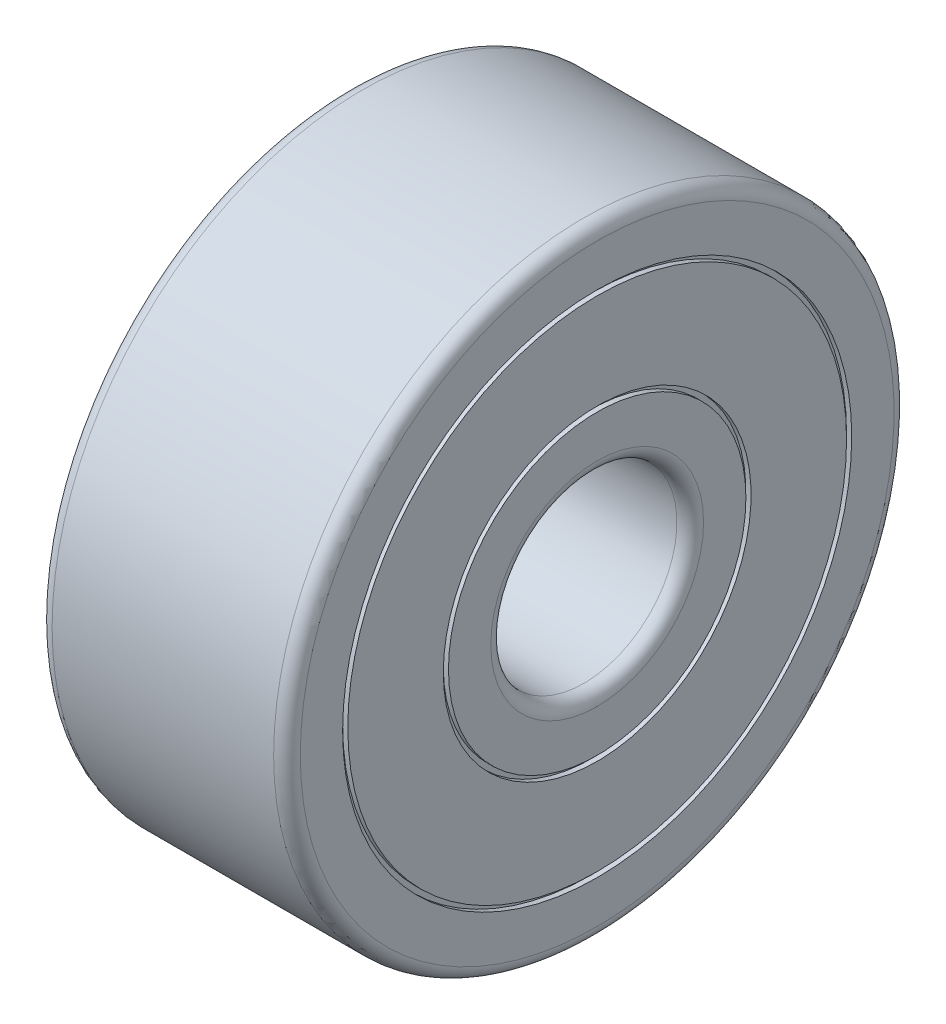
SolidWorks part; units mm, degrees
ref_plane "Front" through (0, 0, 0) normal (0, 0, 1) x (1, 0, 0)
ref_plane "Top" through (0, 0, 0) normal (0, 1, 0) x (1, 0, 0)
ref_plane "Right" through (0, 0, 0) normal (1, 0, 0) x (0, 0, -1)
sketch "Support-Front-Body" plane through (0, 0, 0) normal (0, 0, 1) x (1, 0, 0)
  line L0 (-2, 0) -> (2, 0) construction
  line L1 (0, 5) -> (0, -5) construction
  line L2 (-1.7851, 5) -> (1.7851, 5)
  line L3 (-1.7851, -5) -> (1.7851, -5)
  line L4 (2, 4.7851) -> (2, 1.7149)
  line L5 (2, -4.7851) -> (2, -1.7149)
  line L6 (1.7851, 1.5) -> (-1.7851, 1.5)
  line L7 (1.7851, -1.5) -> (-1.7851, -1.5)
  line L8 (-2, 1.7149) -> (-2, 4.7851)
  line L9 (-2, -1.7149) -> (-2, -4.7851)
  line L10 (2, 1.7149) -> (2, -1.7149) construction
  line L11 (-2, 1.7149) -> (-2, -1.7149) construction
  line L12 (2, 3.25) -> (-2, 3.25) construction
  line L13 (2, -3.25) -> (-2, -3.25) construction
  line L14 (1.7851, 5) -> (2, 3.25) construction
  line L15 (1.7851, -5) -> (2, -3.25) construction
  arc A0 (1.7851, 5) -> (2, 4.7851) centre (1.7851, 4.7851) cw
  arc A1 (1.7851, -5) -> (2, -4.7851) centre (1.7851, -4.7851) ccw
  arc A2 (2, 1.7149) -> (1.7851, 1.5) centre (1.7851, 1.7149) cw
  arc A3 (2, -1.7149) -> (1.7851, -1.5) centre (1.7851, -1.7149) ccw
  arc A4 (-1.7851, 1.5) -> (-2, 1.7149) centre (-1.7851, 1.7149) cw
  arc A5 (-1.7851, -1.5) -> (-2, -1.7149) centre (-1.7851, -1.7149) ccw
  arc A6 (-2, 4.7851) -> (-1.7851, 5) centre (-1.7851, 4.7851) cw
  arc A7 (-2, -4.7851) -> (-1.7851, -5) centre (-1.7851, -4.7851) ccw
  dimension "Diam-Out" = 10
  dimension "Diam-Inner" = 3
  dimension "Width" = 4
  dimension "D4" = 7
sketch "Support-Front-Balls" plane through (0, 0, 0) normal (0, 0, 1) x (1, 0, 0)
  line L0 (-2, 0) -> (2, 0) construction
  line L1 (-2, 0) -> (2, 0) construction
  line L2 (-2, 3.8333) -> (2, 3.8333)
  line L3 (0, 5) -> (2, 3.8333) construction
  line L4 (-2, 1.7149) -> (-2, 4.7851) construction
  line L5 (2, 4.7851) -> (2, 1.7149) construction
  line L6 (-2, 2.6667) -> (2, 2.6667)
  line L7 (2, 3.25) -> (-2, 3.25) construction
  line L8 (0, 5) -> (0, -5) construction
  line L9 (-1.7851, 5) -> (-1.7851, 3.8333) construction
  line L10 (0, 5) -> (0, -5) construction
  line L11 (-1.7851, 3.8333) -> (-1.7851, 2.6667) construction
  line L12 (2, 3.8333) -> (0, 4.3788) construction
  line L13 (2, 3.8333) -> (0, 4.3391) construction
  line L14 (2, 3.25) -> (-2, 3.25) construction
  circle A0 centre (0, 3.25) radius 1.0891
  circle A1 centre (0, -3.25) radius 1.0891
  circle A2 centre (0, 3.25) radius 1.0558
  dimension "D1" = 15
  dimension "Diam-Pitch" = 6.5
sketch "Support-Front-Side" plane through (0, 0, 0) normal (0, 0, 1) x (1, 0, 0)
  line L0 (0, 3.8333) -> (1.5279, 4.1027) construction
  line L1 (-2, 3.8333) -> (2, 3.8333) construction
  line L2 (-2, 2.6667) -> (2, 2.6667) construction
  line L3 (2, 3.25) -> (1.5279, 3.25) construction
  line L4 (2, 4.1027) -> (1.5279, 4.1027)
  line L5 (2, 3.25) -> (-2, 3.25) construction
  line L6 (2, 4.7851) -> (2, 1.7149) construction
  line L7 (2, 2.3973) -> (1.5279, 2.3973)
  line L8 (1.5279, 4.1027) -> (1.5279, 2.3973)
  line L9 (1.5279, 3.25) -> (1.0558, 3.25) construction
  line L10 (1.9168, 4.1027) -> (1.9168, 4.0195)
  line L14 (1.9168, 2.3973) -> (1.9168, 2.4805)
  line L16 (0, 5) -> (0, -5) construction
  line L17 (0, 5) -> (0, -5) construction
  line L18 (1.9168, 4.0195) -> (2, 4.0195)
  line L19 (1.9168, 2.4805) -> (2, 2.4805)
  line L20 (2, 4.0195) -> (1.5279, 4.1027) construction
  line L21 (2, 2.4805) -> (1.5279, 2.3973) construction
  line L22 (-1.9168, 2.4805) -> (-2, 2.4805)
  line L23 (-1.9168, 2.3973) -> (-1.9168, 2.4805)
  line L24 (-2, 2.3973) -> (-1.5279, 2.3973)
  line L25 (-1.5279, 4.1027) -> (-1.5279, 2.3973)
  line L26 (-2, 4.1027) -> (-1.5279, 4.1027)
  line L27 (-1.9168, 4.0195) -> (-2, 4.0195)
  line L28 (-1.9168, 4.1027) -> (-1.9168, 4.0195)
  line L31 (1.5279, 3.25) -> (2, 3.4218) construction
  line L32 (2.4721, 3.25) -> (2, 3.4218) construction
  arc A1 (2, 3.0782) -> (2, 3.4218) centre (2.4721, 3.25) cw
  arc A2 (-2, 3.0782) -> (-2, 3.4218) centre (-2.4721, 3.25) ccw
  circle A3 centre (0, 3.25) radius 1.0558 construction
  dimension "D1" = 10
  dimension "D2" = 20
  dimension "D3" = 10
sketch "Sketch5" plane through (0, 0, 0) normal (0, 0, 1) x (1, 0, 0)
  line L0 (2, 4.7851) -> (2, 1.7149) construction
  line L2 (-2, 1.7149) -> (-2, 4.7851) construction
  line L3 (1.7851, 1.5) -> (-1.7851, 1.5) construction
  line L4 (2, 2.6667) -> (2, 1.7149)
  line L5 (-2, 2.6667) -> (2, 2.6667) construction
  line L6 (-2, 1.7149) -> (-2, 2.6667)
  line L7 (1.7851, 1.5) -> (-1.7851, 1.5)
  line L8 (-2, 2.6667) -> (-0.88, 2.6667)
  line L9 (-2, 0) -> (2, 0) construction
  line L10 (-2, 0) -> (2, 0) construction
  line L11 (0.88, 2.6667) -> (2, 2.6667)
  arc A0 (1.7851, 1.5) -> (2, 1.7149) centre (1.7851, 1.7149) ccw construction
  arc A1 (-2, 1.7149) -> (-1.7851, 1.5) centre (-1.7851, 1.7149) ccw construction
  arc A2 (1.7851, 1.5) -> (2, 1.7149) centre (1.7851, 1.7149) ccw
  arc A3 (-2, 1.7149) -> (-1.7851, 1.5) centre (-1.7851, 1.7149) ccw
  circle A5 centre (0, 3.25) radius 1.0558 construction
  arc A6 (-0.88, 2.6667) -> (0.88, 2.6667) centre (0, 3.25) ccw
revolve "Body-Inner" add sketch "Sketch5" angle 360 about L10
sketch "Sketch7" plane through (0, 0, 0) normal (0, 0, 1) x (1, 0, 0)
  line L0 (2, 3.25) -> (-2, 3.25) construction
  line L1 (2, 3.25) -> (-2, 3.25) construction
  line L2 (2, 3.25) -> (-2, 3.25) construction
  line L3 (1.0891, 3.25) -> (-1.0891, 3.25)
  circle A1 centre (0, 3.25) radius 1.0891 construction
  arc A2 (-1.0891, 3.25) -> (1.0891, 3.25) centre (0, 3.25) ccw
revolve "Body-Balls" add sketch "Sketch7" angle 360 about L1
pattern_circular "CirPattern-Balls" count 6 over 360 about axis through (-2, 0, 0) along (1, 0, 0)
sketch "Sketch8" plane through (0, 0, 0) normal (0, 0, 1) x (1, 0, 0)
  line L0 (-2, 1.7149) -> (-2, 4.7851) construction
  line L1 (-1.7851, 5) -> (1.7851, 5) construction
  line L2 (2, 4.7851) -> (2, 1.7149) construction
  line L4 (-2, 3.8333) -> (-2, 4.7851)
  line L5 (-1.7851, 5) -> (1.7851, 5)
  line L6 (2, 4.7851) -> (2, 3.8333)
  line L7 (-2, 3.8333) -> (2, 3.8333) construction
  line L8 (-2, 3.8333) -> (-0.88, 3.8333)
  line L9 (-2, 0) -> (2, 0) construction
  line L10 (-2, 0) -> (2, 0) construction
  line L11 (0.88, 3.8333) -> (2, 3.8333)
  arc A1 (-1.7851, 5) -> (-2, 4.7851) centre (-1.7851, 4.7851) ccw construction
  arc A2 (2, 4.7851) -> (1.7851, 5) centre (1.7851, 4.7851) ccw construction
  circle A3 centre (0, 3.25) radius 1.0558 construction
  arc A4 (-1.7851, 5) -> (-2, 4.7851) centre (-1.7851, 4.7851) ccw
  arc A5 (2, 4.7851) -> (1.7851, 5) centre (1.7851, 4.7851) ccw
  arc A6 (0.88, 3.8333) -> (-0.88, 3.8333) centre (0, 3.25) ccw
revolve "Body-Out" add sketch "Sketch8" angle 360 about L10
sketch "Sketch12" plane through (0, 0, 0) normal (0, 0, 1) x (1, 0, 0)
  line L0 (2, 4.7851) -> (2, 1.7149) construction
  line L4 (2, 4.1027) -> (2, 4.0195)
  line L5 (1.9168, 4.0195) -> (2, 4.0195) construction
  line L6 (1.9168, 4.1027) -> (1.9168, 4.0195) construction
  line L7 (2, 4.1027) -> (1.5279, 4.1027) construction
  line L11 (1.9168, 4.0195) -> (2, 4.0195)
  line L12 (1.9168, 4.1027) -> (1.9168, 4.0195)
  line L13 (2, 4.1027) -> (1.9168, 4.1027)
  line L14 (2, 2.4805) -> (2, 2.3973)
  line L15 (-2, 0) -> (2, 0) construction
  line L16 (-2, 0) -> (2, 0) construction
  line L17 (-2, 1.7149) -> (-2, 4.7851) construction
  line L21 (2, 2.3973) -> (1.5279, 2.3973) construction
  line L22 (-1.9168, 4.0195) -> (-2, 4.0195) construction
  line L23 (-1.9168, 4.1027) -> (-1.9168, 4.0195) construction
  line L24 (-2, 4.1027) -> (-1.5279, 4.1027) construction
  line L28 (-2, 2.3973) -> (-2, 2.4805)
  line L30 (-2, 2.3973) -> (-1.5279, 2.3973) construction
  line L31 (-1.9168, 2.3973) -> (-1.9168, 2.4805) construction
  line L32 (-2, 4.0195) -> (-2, 4.1027)
  line L33 (1.9168, 2.3973) -> (1.9168, 2.4805) construction
  line L34 (1.9168, 2.4805) -> (2, 2.4805) construction
  line L35 (2, 2.3973) -> (1.9168, 2.3973)
  line L36 (1.9168, 2.3973) -> (1.9168, 2.4805)
  line L37 (1.9168, 2.4805) -> (2, 2.4805)
  line L38 (-1.9168, 4.0195) -> (-2, 4.0195)
  line L39 (-1.9168, 4.1027) -> (-1.9168, 4.0195)
  line L40 (-2, 4.1027) -> (-1.9168, 4.1027)
  line L41 (-1.9168, 2.4805) -> (-2, 2.4805) construction
  line L42 (-2, 2.3973) -> (-1.9168, 2.3973)
  line L43 (-1.9168, 2.3973) -> (-1.9168, 2.4805)
  line L44 (-1.9168, 2.4805) -> (-2, 2.4805)
revolve "Groove" cut sketch "Sketch12" angle 360 about L16
sketch "Sketch9" plane through (0, 0, 0) normal (0, 0, 1) x (1, 0, 0)
  line L8 (-2, 0) -> (2, 0) construction
  line L9 (-2, 0) -> (2, 0) construction
  line L12 (-1.5279, 4.1027) -> (-1.5279, 2.3973) construction
  line L13 (-2, 4.1027) -> (-1.5279, 4.1027) construction
  line L23 (-2, 1.7149) -> (-2, 4.7851) construction
  line L24 (-2, 3.4218) -> (-2, 4.0195)
  line L25 (-1.9168, 4.1027) -> (-1.9168, 4.0195) construction
  line L26 (-1.9168, 4.0195) -> (-2, 4.0195) construction
  line L27 (-1.5279, 4.1027) -> (-1.5279, 2.3973)
  line L28 (-1.9168, 4.1027) -> (-1.5279, 4.1027)
  line L29 (-1.9168, 4.1027) -> (-1.9168, 4.0195)
  line L30 (-1.9168, 4.0195) -> (-2, 4.0195)
  line L31 (-2, 2.4805) -> (-2, 3.0782)
  line L32 (-1.9168, 2.4805) -> (-2, 2.4805) construction
  line L33 (-1.9168, 2.3973) -> (-1.9168, 2.4805) construction
  line L34 (-2, 2.3973) -> (-1.5279, 2.3973) construction
  line L35 (-1.9168, 2.4805) -> (-2, 2.4805)
  line L36 (-1.9168, 2.3973) -> (-1.9168, 2.4805)
  line L37 (-1.9168, 2.3973) -> (-1.5279, 2.3973)
  arc A1 (-2, 3.0782) -> (-2, 3.4218) centre (-2.4721, 3.25) ccw construction
  arc A3 (-2, 3.0782) -> (-2, 3.4218) centre (-2.4721, 3.25) ccw
revolve "Side-RS-Left" [suppressed] add sketch "Sketch9" angle 360 about L9
sketch "Sketch10" plane through (0, 0, 0) normal (0, 0, 1) x (1, 0, 0)
  line L0 (2, 4.7851) -> (2, 1.7149) construction
  line L4 (2, 4.0195) -> (2, 3.4218)
  line L5 (1.5279, 4.1027) -> (1.5279, 2.3973) construction
  line L6 (2, 4.1027) -> (1.5279, 4.1027) construction
  line L7 (1.9168, 4.1027) -> (1.9168, 4.0195) construction
  line L8 (2, 3.0782) -> (2, 2.4805)
  line L9 (-2, 0) -> (2, 0) construction
  line L10 (-2, 0) -> (2, 0) construction
  line L13 (1.9168, 4.0195) -> (2, 4.0195) construction
  line L14 (1.5279, 4.1027) -> (1.5279, 2.3973)
  line L17 (1.9168, 4.1027) -> (1.5279, 4.1027)
  line L18 (1.9168, 4.1027) -> (1.9168, 4.0195)
  line L19 (1.9168, 4.0195) -> (2, 4.0195)
  line L20 (1.9168, 2.4805) -> (2, 2.4805) construction
  line L22 (2, 2.3973) -> (1.5279, 2.3973) construction
  line L23 (1.9168, 2.4805) -> (2, 2.4805)
  line L24 (1.9168, 2.3973) -> (1.9168, 2.4805) construction
  line L25 (1.9168, 2.3973) -> (1.5279, 2.3973)
  line L26 (1.9168, 2.3973) -> (1.9168, 2.4805)
  arc A1 (2, 3.4218) -> (2, 3.0782) centre (2.4721, 3.25) ccw construction
  arc A2 (2, 3.4218) -> (2, 3.0782) centre (2.4721, 3.25) ccw
revolve "Side-RS-Right" [suppressed] add sketch "Sketch10" angle 360 about L10
sketch "Sketch18" plane through (0, 0, 0) normal (0, 0, 1) x (1, 0, 0)
  line L0 (-2, 2.3973) -> (-1.5279, 2.3973) construction
  line L1 (-1.5279, 4.1027) -> (-1.5279, 2.3973) construction
  line L2 (-2, 1.7149) -> (-2, 4.7851) construction
  line L3 (-2, 4.1027) -> (-1.5279, 4.1027) construction
  line L4 (-1.9168, 2.3973) -> (-1.5279, 2.3973)
  line L5 (-1.5279, 4.1027) -> (-1.5279, 2.3973)
  line L6 (-2, 2.4805) -> (-2, 4.0195)
  line L7 (-1.9168, 4.1027) -> (-1.5279, 4.1027)
  line L8 (-2, 0) -> (2, 0) construction
  line L9 (-2, 0) -> (2, 0) construction
  line L10 (-1.9168, 2.4805) -> (-2, 2.4805) construction
  line L11 (-1.9168, 2.3973) -> (-1.9168, 2.4805) construction
  line L12 (-1.9168, 4.0195) -> (-2, 4.0195) construction
  line L13 (-1.9168, 4.1027) -> (-1.9168, 4.0195) construction
  line L14 (-1.9168, 2.4805) -> (-2, 2.4805)
  line L15 (-1.9168, 2.3973) -> (-1.9168, 2.4805)
  line L16 (-1.9168, 4.0195) -> (-2, 4.0195)
  line L17 (-1.9168, 4.1027) -> (-1.9168, 4.0195)
revolve "Side-Z-Left" add sketch "Sketch18" angle 360 about L9
sketch "Sketch19" plane through (0, 0, 0) normal (0, 0, 1) x (1, 0, 0)
  line L0 (1.5279, 4.1027) -> (1.5279, 2.3973) construction
  line L1 (2, 4.1027) -> (1.5279, 4.1027) construction
  line L2 (1.9168, 4.1027) -> (1.9168, 4.0195) construction
  line L3 (1.9168, 4.0195) -> (2, 4.0195) construction
  line L4 (1.5279, 4.1027) -> (1.5279, 2.3973)
  line L5 (1.9168, 4.1027) -> (1.5279, 4.1027)
  line L6 (1.9168, 4.1027) -> (1.9168, 4.0195)
  line L7 (1.9168, 4.0195) -> (2, 4.0195)
  line L8 (2, 2.3973) -> (1.5279, 2.3973) construction
  line L9 (1.9168, 2.3973) -> (1.9168, 2.4805) construction
  line L10 (1.9168, 2.4805) -> (2, 2.4805) construction
  line L11 (2, 4.7851) -> (2, 1.7149) construction
  line L12 (1.9168, 2.3973) -> (1.5279, 2.3973)
  line L13 (1.9168, 2.3973) -> (1.9168, 2.4805)
  line L14 (1.9168, 2.4805) -> (2, 2.4805)
  line L15 (2, 4.0195) -> (2, 2.4805)
  line L16 (-2, 0) -> (2, 0) construction
  line L17 (-2, 0) -> (2, 0) construction
revolve "Side-Z-Right" add sketch "Sketch19" angle 360 about L17
equation "\"Num-Balls@CirPattern-Balls\" =  ( PI * (\"Diam-Out@Support-Front-Body\" + \"Diam-Inner@Support-Front-Body\")/2)/(\"Width@Support-Front-Body\"*0.9)"
